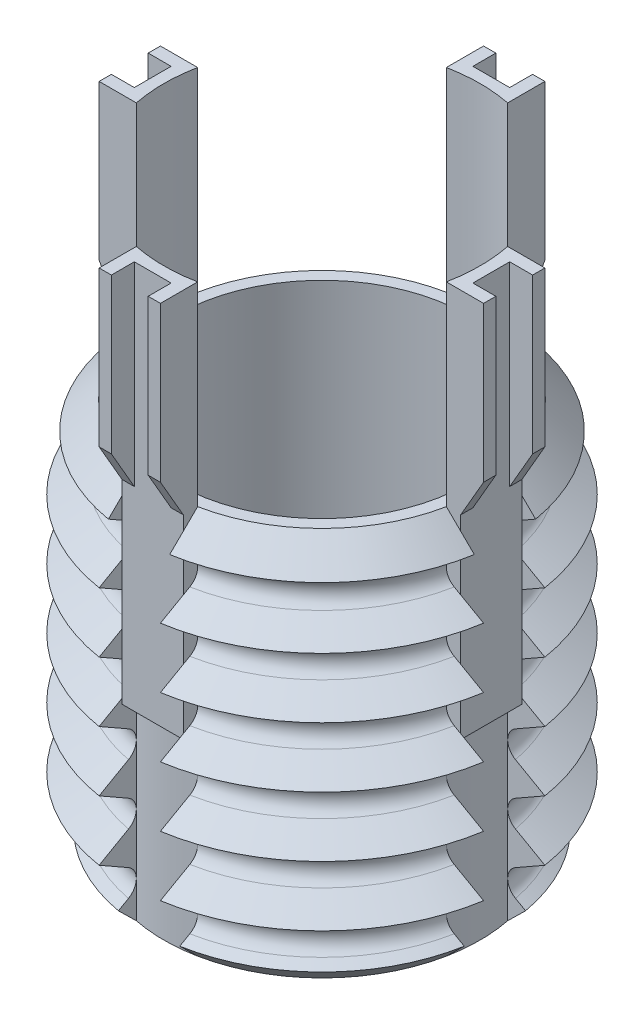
SolidWorks part; units mm, degrees
ref_plane "Front Plane" through (0, 0, 0) normal (0, 0, 1) x (1, 0, 0)
ref_plane "Top Plane" through (0, 0, 0) normal (0, 1, 0) x (1, 0, 0)
ref_plane "Right Plane" through (0, 0, 0) normal (1, 0, 0) x (0, 0, -1)
sketch "Sketch1" plane through (0, 0, 0) normal (0, 1, 0) x (1, 0, 0)
  circle A0 centre (0, 0) radius 6.35
  circle A1 centre (0, 0) radius 4.7625
  dimension "D1" = 9.525
  dimension "D2" = 12.7
extrude "Boss-Extrude1" add sketch "Sketch1" along normal mid plane 12.7
sketch "Sketch2" plane through (0, 6.35, 0) normal (0, 1, 0) x (1, 0, 0)
  circle A0 centre (0, 0) radius 5.155
  dimension "D1" = 10.31
extrude "Cut-Extrude1" cut sketch "Sketch2" against normal through all draft 45 flip side to cut
mirror "Mirror1" about plane through (0, 0, 0) normal (0, 1, 0) of "Cut-Extrude1"
sketch "Sketch3" plane through (0, 6.35, 0) normal (0, 1, 0) x (1, 0, 0)
  line L0 (-6.35, 0) -> (-6.35, 1)
  line L1 (-6.35, 1) -> (-5.0571, 1)
  line L2 (-6.35, 0) -> (-6.35, -1)
  line L3 (-6.35, -1) -> (-5.0571, -1)
  arc A0 (-5.0571, 1) -> (-5.0571, -1) centre (0, 0) ccw
  circle A1 centre (0, 0) radius 5.155 construction
  circle A2 centre (0, 0) radius 6.35 construction
  dimension "D1" = 2
extrude "Cut-Extrude2" cut sketch "Sketch3" against normal through all
sketch "Sketch4" plane through (0, 0, 0) normal (0, 0, 1) x (1, 0, 0)
  line L1 (6.35, -5.155) -> (6.35, -6.135)
  line L3 (6.35, -6.135) -> (5.4062, -5.5901)
  line L6 (5.4062, -4.7199) -> (6.35, -4.175)
  line L10 (6.35, -5.155) -> (6.35, 5.155) construction
  line L12 (6.35, -4.175) -> (6.35, -5.155)
  arc A1 (5.4062, -5.5901) -> (5.4062, -4.7199) centre (5.6574, -5.155) cw
  point P5 (5.155, -6.35)
  point P9 (5.155, -5.155)
  dimension "D2" = 60
  dimension "D1" = 1.96
revolve "Cut-Revolve1" cut sketch "Sketch4" angle 360 about axis through (0, 6.35, 0) along (0, -1, 0)
pattern_linear "LPattern1" count 6 spacing 1.96 along (0, 1, 0) of "Cut-Revolve1"
sketch "Sketch5" plane through (0, 6.35, 0) normal (0, -1, 0) x (1, 0, 0)
  line L0 (-5.0571, 1) -> (-6.2708, 1)
  line L1 (-5.0571, -1) -> (-6.2708, -1)
  line L2 (-5.5225, -0.6) -> (-6.2708, -0.6)
  line L3 (-5.5225, 0.6) -> (-6.2708, 0.6)
  line L4 (-6.2708, 1) -> (-6.2708, 0.6)
  line L5 (-6.2708, -0.6) -> (-6.2708, -1)
  line L6 (-5.5225, 0.6) -> (-5.5225, -0.6)
  arc A0 (-5.0571, 1) -> (-5.0571, -1) centre (0, 0) ccw
  arc A1 (-5.0571, 1) -> (-5.0571, -1) centre (0, 0) ccw construction
  arc A3 (-5.5225, 0.6) -> (-5.5225, -0.6) centre (0, 0) ccw construction
  dimension "D1" = 0.4
extrude "Boss-Extrude2" add sketch "Sketch5" along normal mid plane 12.7
sketch "Sketch6" plane through (0, 0, 0) normal (0, 0, 1) x (1, 0, 0)
  line L9 (-5.5225, 6.35) -> (-6.2708, 7.646)
  line L10 (-5.5225, 0) -> (-5.5225, 12.7) construction
  line L11 (-6.2708, 0) -> (-6.2708, 12.7) construction
  line L12 (-6.2708, 7.646) -> (-6.2708, 0)
  line L13 (-6.2708, 0) -> (-5.5225, 0)
  line L15 (-5.5225, 0) -> (-5.5225, 6.35)
  line L16 (4.7625, 6.35) -> (-4.7625, 6.35) construction
  dimension "D1" = 150
extrude "Cut-Extrude3" cut sketch "Sketch6" against normal mid plane 2
pattern_circular "CirPattern1" count 4 over 360 about axis through (0, 0, 0) along (0, 1, 0) of "Cut-Extrude2", "Boss-Extrude2", "Cut-Extrude3"
